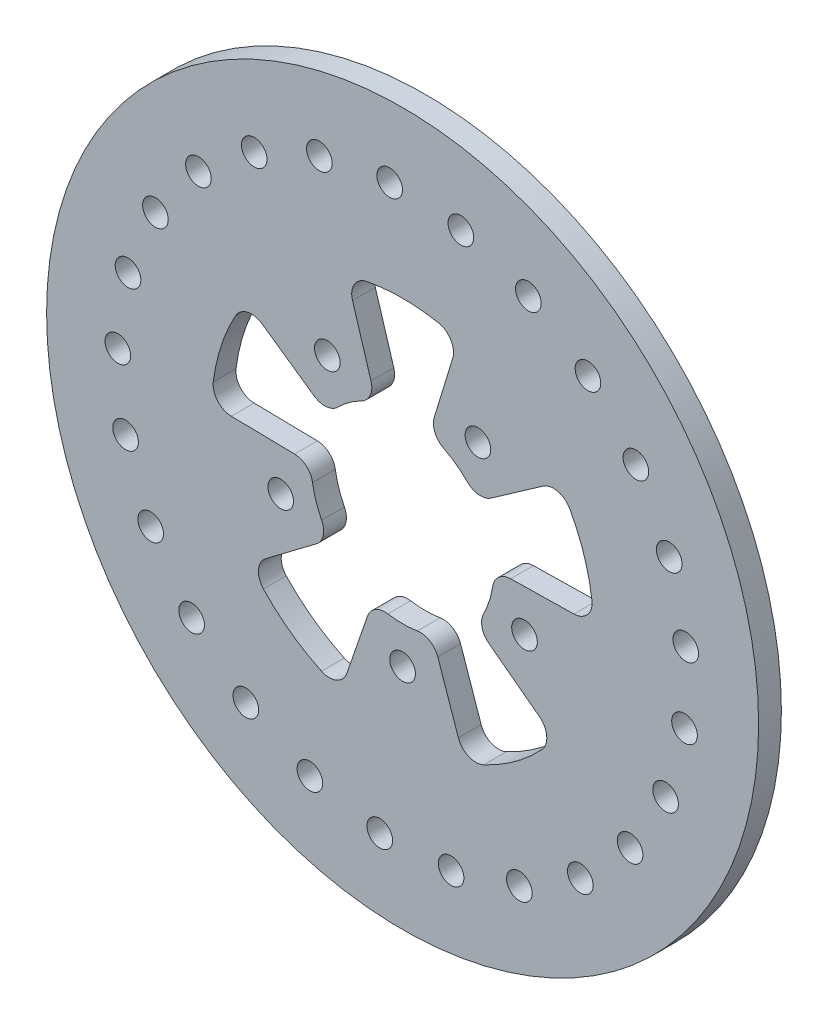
SolidWorks part; units mm, degrees
ref_plane "Front Plane" through (0, 0, 0) normal (0, 0, 1) x (1, 0, 0)
ref_plane "Top Plane" through (0, 0, 0) normal (0, 1, 0) x (1, 0, 0)
ref_plane "Right Plane" through (0, 0, 0) normal (1, 0, 0) x (0, 0, -1)
sketch "Sketch1" plane through (0, 0, 0) normal (0, 0, 1) x (1, 0, 0)
  circle A0 centre (0, 0) radius 125
  circle A1 centre (0, 0) radius 32
  dimension "D1" = 64
  dimension "D2" = 250
extrude "Boss-Extrude1" add sketch "Sketch1" along normal mid plane 8
sketch "Sketch2" plane through (0, 0, 4) normal (0, 0, 1) x (1, 0, 0)
  line L0 (0, 0) -> (0, 133.44) construction
  line L1 (9.3559, 30.6018) -> (19.5889, 64.0724)
  line L2 (-9.3559, 30.6018) -> (-19.5889, 64.0724)
  circle A0 centre (0, 0) radius 32 construction
  arc A1 (9.3559, 30.6018) -> (-9.3559, 30.6018) centre (0, 0) ccw
  arc A2 (19.5889, 64.0724) -> (-19.5889, 64.0724) centre (0, 0) ccw
  circle A3 centre (0, 0) radius 67 construction
  circle A4 centre (0, 0) radius 32 construction
  dimension "D2" = 34
  dimension "D3" = 17
  dimension "D1" = 35
extrude "Cut-Extrude1" cut sketch "Sketch2" against normal up to next contours L2 A2 L1 A1
sketch "Sketch3" plane through (0, 0, 4) normal (0, 0, 1) x (1, 0, 0)
  line L0 (0, 90.092) -> (0, 0) construction
  line L1 (0, 0) -> (-26.4503, 36.4058) construction
  circle A0 centre (0, 0) radius 45 construction
  circle A1 centre (-26.4503, 36.4058) radius 4.5
  dimension "D1" = 90
  dimension "D3" = 9
  dimension "D2" = 36
extrude "Cut-Extrude2" cut sketch "Sketch3" against normal up to next
pattern_circular "CirPattern1" count 5 over 360 about axis through (0, 0, 0) along (0, 0, 1) of "Cut-Extrude2", "Cut-Extrude1"
other "Fill Pattern1" parameters "D10"=9, "D5"=0, "D6"=0, "D4"=100, "D9"=25, "D3"=10
fillet "Fillet1" radius 6.5 20 edges at (66.9898, 1.1693, 0) (21.8131, -63.3497, 0) (-19.5889, 64.0724, 0) (-54.8832, 38.4296, 0) (-53.5086, -40.3216, 0) (19.5889, 64.0724, 0) (54.8832, 38.4296, 0) (53.5086, -40.3216, 0) (-21.8131, -63.3497, 0) (-66.9898, 1.1693, 0) (31.9951, 0.5585, 0) (25.5563, -19.2581, 0) (10.4182, -30.2566, 0) (-10.4182, -30.2566, 0) (-25.5563, -19.2581, 0) (-31.9951, 0.5585, 0) (-9.3559, 30.6018, 0) (26.2129, 18.3544, 0) (9.3559, 30.6018, 0) (-26.2129, 18.3544, 0)
